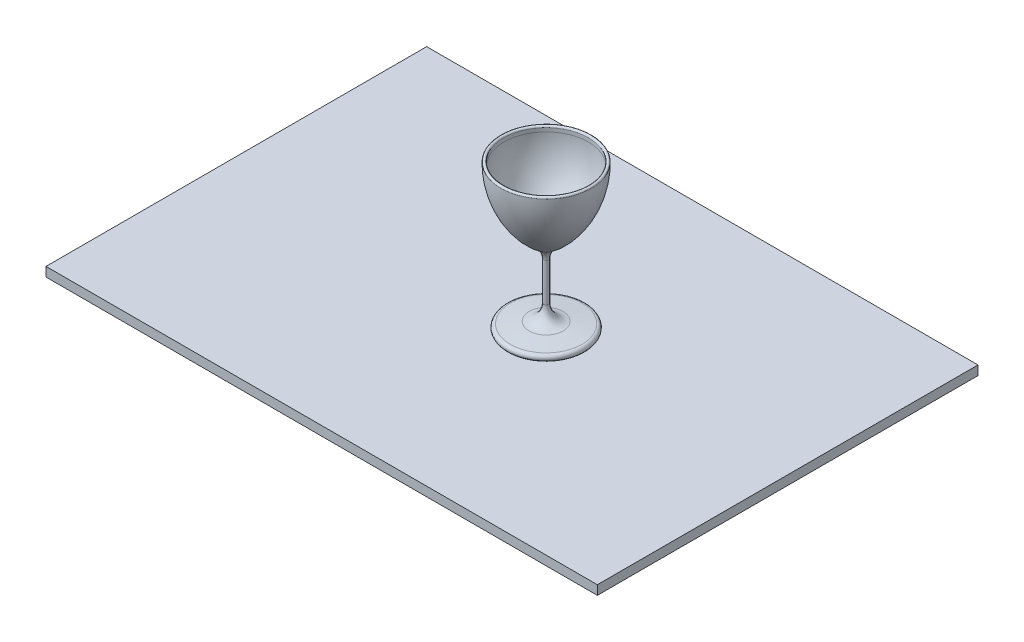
SolidWorks part; units mm, degrees
other "Camera1"
ref_plane "Front Plane" through (0, 0, 0) normal (0, 0, 1) x (1, 0, 0)
ref_plane "Top Plane" through (0, 0, 0) normal (0, 1, 0) x (1, 0, 0)
ref_plane "Right Plane" through (0, 0, 0) normal (1, 0, 0) x (0, 0, -1)
sketch "Sketch1" plane through (0, 0, 0) normal (0, 0, 1) x (1, 0, 0)
  line L0 (0, 0) -> (38.7475, 0)
  line L1 (38.7475, 7.0417) -> (18.3328, 9.3548)
  line L2 (2.8468, 26.6946) -> (2.8468, 68.3428)
  line L3 (0, 0) -> (0, 80.2213)
  line L4 (45.6932, 154.4238) -> (45.6932, 158.3855)
  arc A0 (38.7475, 0) -> (38.7475, 7.0417) centre (38.7475, 3.5208) ccw
  arc A1 (18.3328, 9.3548) -> (2.8468, 26.6946) centre (20.2976, 26.6946) cw
  arc A2 (2.8468, 68.3428) -> (8.9462, 80.2213) centre (17.463, 68.3428) cw
  arc A3 (8.9462, 80.2213) -> (49.0826, 158.3855) centre (-47.0967, 158.3855) ccw
  arc A4 (45.6932, 158.3855) -> (49.0826, 158.3855) centre (47.3879, 158.3855) cw
  arc A5 (0, 80.2213) -> (45.6932, 154.4238) centre (-37.4013, 154.4226) ccw
revolve "Revolve1" add sketch "Sketch1" angle 360 about L3
sketch "Sketch2" plane through (0, 0, 0) normal (0, 1, 0) x (1, 0, 0)
  line L1 (-331.2444, 201.992) -> (265.2194, 201.992)
  line L2 (-331.2444, 201.992) -> (-331.2444, -209.8254)
  line L3 (-331.2444, -209.8254) -> (265.2194, -209.8254)
  line L4 (265.2194, 201.992) -> (265.2194, -209.8254)
extrude "Boss-Extrude1" add sketch "Sketch2" against normal blind 10 separate body
